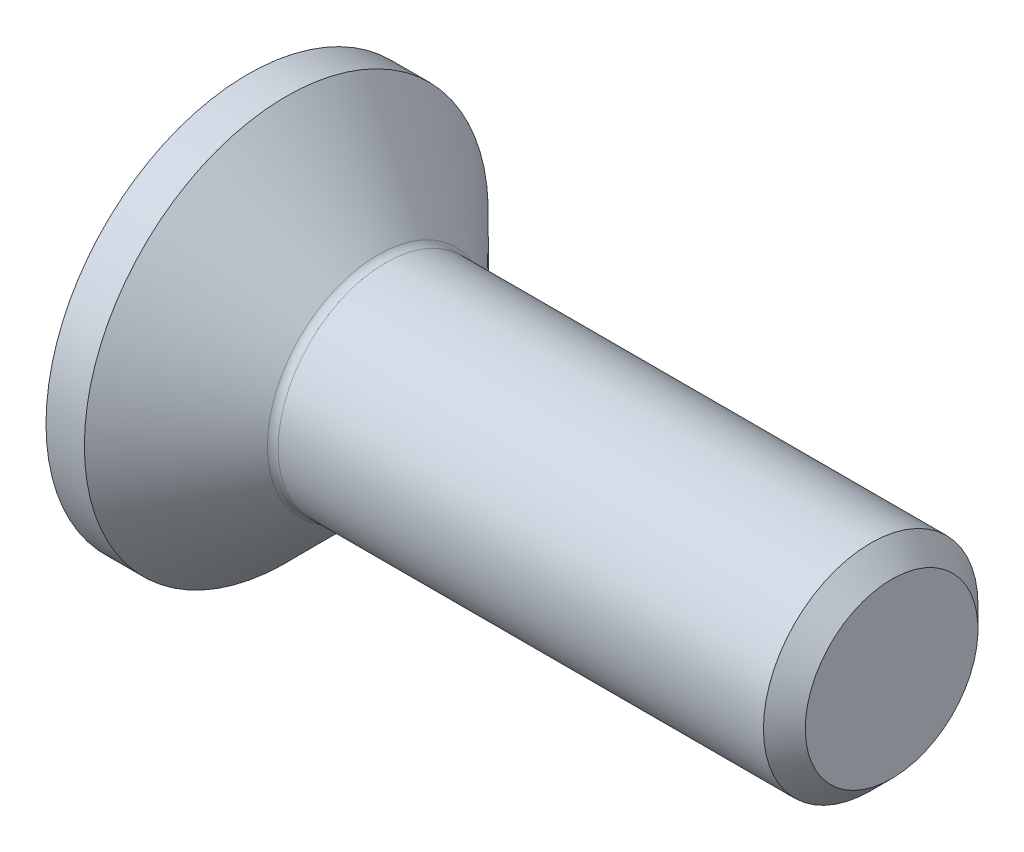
SolidWorks part; units mm, degrees
ref_plane "Plane1" through (0, 0, 0) normal (0, 0, 1) x (1, 0, 0)
ref_plane "Plane2" through (0, 0, 0) normal (0, 1, 0) x (1, 0, 0)
ref_plane "Plane3" through (0, 0, 0) normal (1, 0, 0) x (0, 0, -1)
revolve "BaseBody" add sketch "BodySke"
sketch "BodySke" plane through (0, 0, 0) normal (0, 0, 1) x (1, 0, 0)
  line L0 (0, 0) -> (0, 3.765)
  line L1 (0.715, 3.765) -> (2.48, 2)
  line L2 (0, 3.765) -> (0.715, 3.765)
  line L3 (2.48, 2) -> (11.61, 2)
  line L4 (12, 1.61) -> (12, 0)
  line L5 (12, 0) -> (0, 0)
  line L6 (0, 0) -> (127, 0) construction
  line L7 (0.715, -3.765) -> (2.48, -2) construction
  line L8 (12, 1.61) -> (11.61, 2)
  line L9 (0, -3.765) -> (0.715, -3.765) construction
  line L10 (12, -1.61) -> (11.61, -2) construction
  line L11 (3.18, 8.35) -> (3.18, -13.875) construction
  line L12 (0, 19.05) -> (0, -3.175) construction
  dimension "D1" = 0.715
  dimension "Diameter" = 4
  dimension "Head_ht" = 2.48
  dimension "Length" = 12
  dimension "Body_ch_ang" = 45
  dimension "Head_dia" = 7.53
  dimension "Minor_dia" = 3.22
  dimension "Head_ang" = 90
  dimension "Advance" = 0.7
  dimension "Thread_nom" = 12
fillet "Fillet1" radius 0.2 1 edges at (2.48, 0, 2)
sketch "Sketch2" plane through (0, 0, 0) normal (0, 0, 1) x (1, 0, 0)
  line L0 (0, 1.25) -> (1.5, 1.25)
  line L1 (1.5, 1.25) -> (2.2217, 0)
  line L2 (0, 0) -> (127, 0) construction
  line L3 (2.2217, 0) -> (0, 0)
  line L4 (0, 0) -> (0, 1.25)
  line L5 (0, -1.25) -> (1.5, -1.25) construction
  line L6 (0, 0) -> (47.625, 0) construction
  line L8 (0, 3.765) -> (0, -3.765) construction
  dimension "D2" = 60
  dimension "PreBroach_depth" = 1.5
  dimension "PreBroach_dia" = 2.5
revolve "PreBroach" cut sketch "Sketch2" angle 360 about L6
sketch "Sketch3" plane through (0, 0, 0) normal (-1, 0, 0) x (0, 0, 1)
  line L0 (-1.25, -0.7217) -> (-1.25, 0.7217)
  line L1 (-1.25, 0.7217) -> (0, 1.4434)
  line L2 (0, 1.4434) -> (1.25, 0.7217)
  line L3 (1.25, 0.7217) -> (1.25, -0.7217)
  line L4 (1.25, -0.7217) -> (0, -1.4434)
  line L5 (0, -1.4434) -> (-1.25, -0.7217)
  dimension "D1" = 1.25
  dimension "D2" = 1.25
  dimension "D3" = 2.5
  dimension "Hex_size" = 2.5
extrude "Hex" cut sketch "Sketch3" against normal blind 1.5
sketch "ThdSchSke" plane through (0, 0, 0) normal (0, 0, 1) x (1, 0, 0)
  line L0 (4.58, -1.61) -> (4.3069, -2)
  line L1 (4.58, -1.61) -> (4.8531, -2)
  line L2 (4.8531, -2) -> (4.8531, -2.5)
  line L3 (-3.175, 0) -> (5.1513, 0) construction
  line L4 (0, 3.765) -> (0, -3.765) construction
  line L5 (4.8531, -2.5) -> (4.3069, -2.5)
  line L6 (4.3069, -2.5) -> (4.3069, -2)
  dimension "Thread_minor" = 3.22
  dimension "Diameter" = 4
  dimension "Start" = 4.58
  dimension "SideAngle" = 55
  dimension "VeeAngle" = 70
  dimension "Overcut" = 5
revolve "ThreadSchematic" [suppressed] cut sketch "ThdSchSke" angle 360 about L3
pattern_linear "ThdSchPat" [suppressed]
equation "\"Thread_minor@ThreadCosmetic\"  =  \"Minor_dia@BodySke\""
equation "\"D1@Sketch3\" = \"Hex_size@Sketch3\" / 2"
equation "\"D2@Sketch3\" = \"D1@Sketch3\""
equation "\"D3@Sketch3\" = \"Hex_size@Sketch3\""
equation "\"Thread_length@ThreadCosmetic\" = ((sgn( (\"Length@BodySke\" - \"Advance@BodySke\" * 3.0 - \"Head_ht@BodySke\" ) - \"Thread_nom@BodySke\" )-1)*( (\"Length@BodySke\" - \"Advance@BodySke\" * 3.0 - \"Head_ht@BodySke\" "
equation "\"Thread_minor@ThdSchSke\" = \"Minor_dia@BodySke\""
equation "\"Diameter@ThdSchSke\" = \"Diameter@BodySke\""
equation "\"Overcut@ThdSchSke\" = \"Diameter@BodySke\" * 1.25"
equation "\"Start@ThdSchSke\" = 0.000001 + \"Length@BodySke\" - \"Thread_length@ThreadCosmetic\"  '---Countersunk---"
equation "\"Num_threads@ThdSchPat\" = int( \"Thread_length@ThreadCosmetic\" / \"Advance@BodySke\" + 0.999 )  + 1"
equation "\"Advance@ThdSchPat\" = \"Thread_length@ThreadCosmetic\" /  (\"Num_threads@ThdSchPat\" - 1) 'relax it"
equation "\"Num_threads@ThdSchPat\" = \"Num_threads@ThdSchPat\" - sgn( \"Num_threads@ThdSchPat\" - 1) '---chamfered tips only---"
